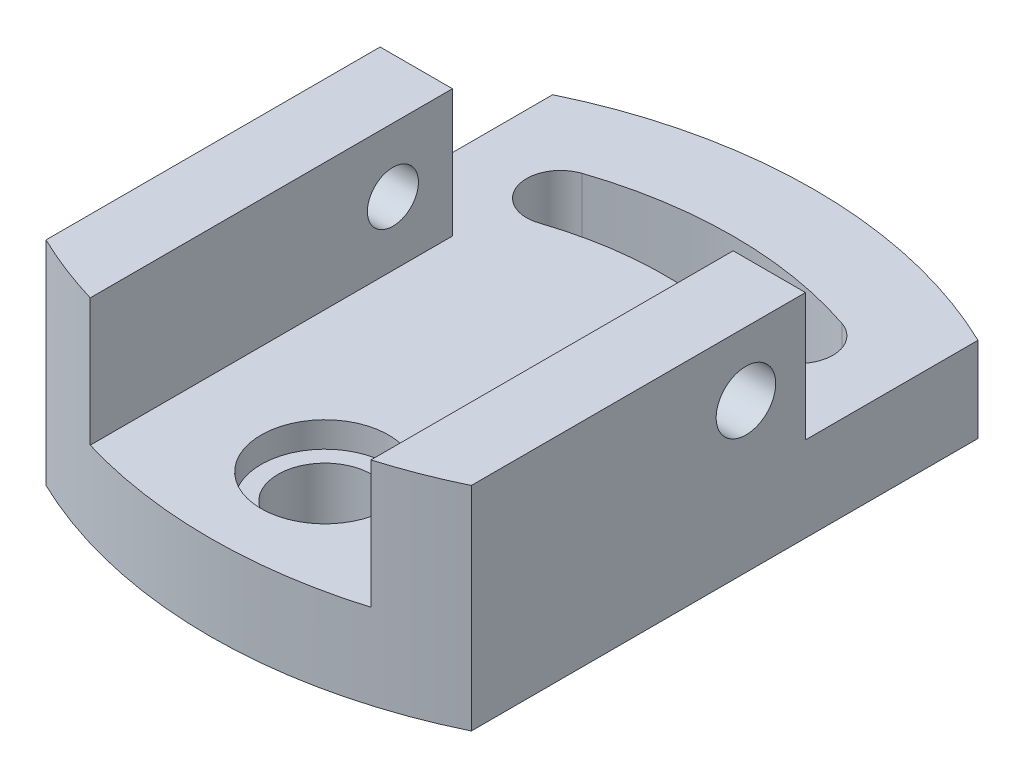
SolidWorks part; units mm, degrees
ref_plane "Front Plane" through (0, 0, 0) normal (0, 0, 1) x (1, 0, 0)
ref_plane "Top Plane" through (0, 0, 0) normal (0, 1, 0) x (1, 0, 0)
ref_plane "Right Plane" through (0, 0, 0) normal (1, 0, 0) x (0, 0, -1)
sketch "Sketch1" plane through (0, 0, 0) normal (0, 1, 0) x (1, 0, 0)
  line L1 (50, -71) -> (-50, -71)
  line L2 (50, -71) -> (50, 71)
  line L3 (50, 71) -> (-50, 71)
  line L4 (-50, -71) -> (-50, 71)
  line L5 (50, -71) -> (-50, 71) construction
  line L6 (50, 71) -> (-50, -71) construction
  point P0 (0, 0)
  dimension "D1" = 100
  dimension "D2" = 142
extrude "Boss-Extrude1" add sketch "Sketch1" along normal blind 50
sketch "Sketch2" plane through (0, 0, 71) normal (0, 0, 1) x (1, 0, 0)
  line L0 (-50, 50) -> (50, 50) construction
  line L1 (-33, 50) -> (33, 50)
  line L2 (-33, 50) -> (-33, 20)
  line L3 (-33, 20) -> (33, 20)
  line L4 (33, 50) -> (33, 20)
  point P6 (0, 50)
  dimension "D1" = 30
  dimension "D2" = 66
extrude "Cut-Extrude1" cut sketch "Sketch2" against normal up to next
sketch "Sketch6" plane through (0, 50, 0) normal (0, 1, 0) x (1, 0, 0)
  line L0 (50, -71) -> (50, 71) construction
  line L1 (-50, 71) -> (50, 71)
  line L2 (-50, 71) -> (-50, 19)
  line L3 (-50, 19) -> (50, 19)
  line L4 (50, 71) -> (50, 19)
  line L5 (-33, -71) -> (33, -71) construction
  dimension "D1" = 90
extrude "Cut-Extrude2" cut sketch "Sketch6" against normal up to surface (30 mm away)
sketch "Sketch9" plane through (0, 20, 0) normal (0, 1, 0) x (1, 0, 0)
  line L0 (-33, -71) -> (33, -71) construction
  arc A0 (28, 39.4266) -> (-28, 39.4266) centre (0, -44) ccw construction
  arc A1 (30.5455, 47.0109) -> (-30.5455, 47.0109) centre (0, -44) ccw
  arc A2 (25.4545, 31.8424) -> (-25.4545, 31.8424) centre (0, -44) ccw
  arc A3 (25.4545, 31.8424) -> (30.5455, 47.0109) centre (28, 39.4266) ccw
  arc A4 (-30.5455, 47.0109) -> (-25.4545, 31.8424) centre (-28, 39.4266) ccw
  circle A5 centre (0, -44) radius 5
  point P3 (0, 44)
  point P12 (0, -44)
  point P13 (0, 0)
  dimension "D1" = 10
  dimension "D3" = 88
  dimension "D4" = 8
  dimension "D5" = 56
  dimension "D2" = 27
  dimension "D6" = 44
extrude "Cut-Extrude3" cut sketch "Sketch9" against normal up to next
sketch "Sketch10" plane through (0, 50, 0) normal (0, 1, 0) x (1, 0, 0)
  line L0 (-50, 71) -> (-50, 19) construction
  line L1 (50, 19) -> (50, 71) construction
  line L2 (-50, 19) -> (-50, -71) construction
  line L3 (50, -71) -> (50, 19) construction
  line L4 (-50, -59.5616) -> (-50, -71)
  line L5 (-50, -71) -> (50, -71)
  line L6 (50, -71) -> (50, -59.5616)
  line L7 (50, 59.5616) -> (50, 71)
  line L8 (50, 71) -> (-50, 71)
  line L9 (-50, 71) -> (-50, 59.5616)
  arc A0 (-50, 59.5616) -> (50, 59.5616) centre (0, -44) cw
  arc A1 (-50, -59.5616) -> (50, -59.5616) centre (0, 44) ccw
  dimension "D1" = 115
  dimension "D2" = 115
  dimension "D3" = 88
extrude "Cut-Extrude4" cut sketch "Sketch10" against normal through all contours L9 A0 L8 | L8 A0 L7 | A1 L5 L6 | A1 M2 M3 M4 | A1 L5 M4
hole_wizard "Hole2" positions "Sketch11" profile "Sketch12" legacy
sketch "Sketch11" plane through (0, 20, 0) normal (0, 1, 0) x (1, 0, 0)
  point P0 (0, -44)
sketch "Sketch12" plane through (0, 20, 44) normal (1, 0, 0) x (0, 0, 1)
  line L0 (0, 0) -> (0, 20)
  line L1 (0, 20) -> (11, 20)
  line L2 (11, 20) -> (11, 6)
  line L3 (11, 6) -> (15, 6)
  line L4 (15, 6) -> (15, 0)
  line L5 (15, 0) -> (0, 0)
  line L6 (0, 110) -> (0, -10) construction
  dimension "Diameter" = 22
  dimension "Depth" = 20
  dimension "C-Bore Diameter" = 30
  dimension "C-Bore Depth" = 6
sketch "Sketch13" plane through (50, 0, 0) normal (1, 0, 0) x (0, 0, -1)
  line L0 (19, 20) -> (19, 50) construction
  line L1 (-59.5616, 50) -> (19, 50) construction
  circle A0 centre (5, 35) radius 7
  dimension "D3" = 14
  dimension "D1" = 14
  dimension "D2" = 15
extrude "Cut-Extrude5" cut sketch "Sketch13" against normal blind 50
sketch "Sketch14" plane through (-50, 0, 0) normal (-1, 0, 0) x (0, 0, 1)
  line L0 (-19, 20) -> (-19, 50) construction
  line L1 (-19, 50) -> (59.5616, 50) construction
  circle A0 centre (-5, 35) radius 6
  dimension "D3" = 12
  dimension "D1" = 14
  dimension "D2" = 15
extrude "Cut-Extrude6" cut sketch "Sketch14" against normal blind 50
